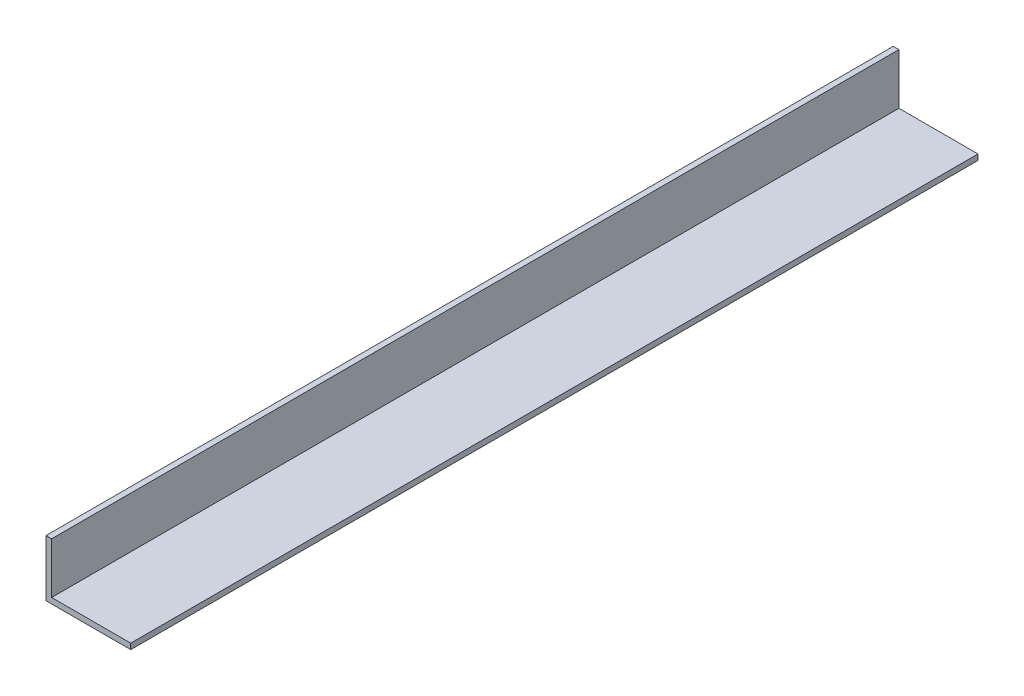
SolidWorks part; units mm, degrees
ref_plane "前视基准面" through (0, 0, 0) normal (0, 0, 1) x (1, 0, 0)
ref_plane "上视基准面" through (0, 0, 0) normal (0, 1, 0) x (1, 0, 0)
ref_plane "右视基准面" through (0, 0, 0) normal (1, 0, 0) x (0, 0, -1)
sketch "草图1" plane through (0, 0, 0) normal (0, 0, 1) x (1, 0, 0)
  line L0 (0, 0) -> (0, 18)
  line L1 (0, 18) -> (-2, 18)
  line L2 (-2, 18) -> (-2, -2)
  line L3 (-2, -2) -> (28, -2)
  line L4 (28, -2) -> (28, 0)
  line L5 (28, 0) -> (0, 0)
  dimension "D1" = 20
  dimension "D2" = 18
  dimension "D3" = 30
  dimension "D4" = 2
extrude "凸台-拉伸1" add sketch "草图1" along normal mid plane 300
